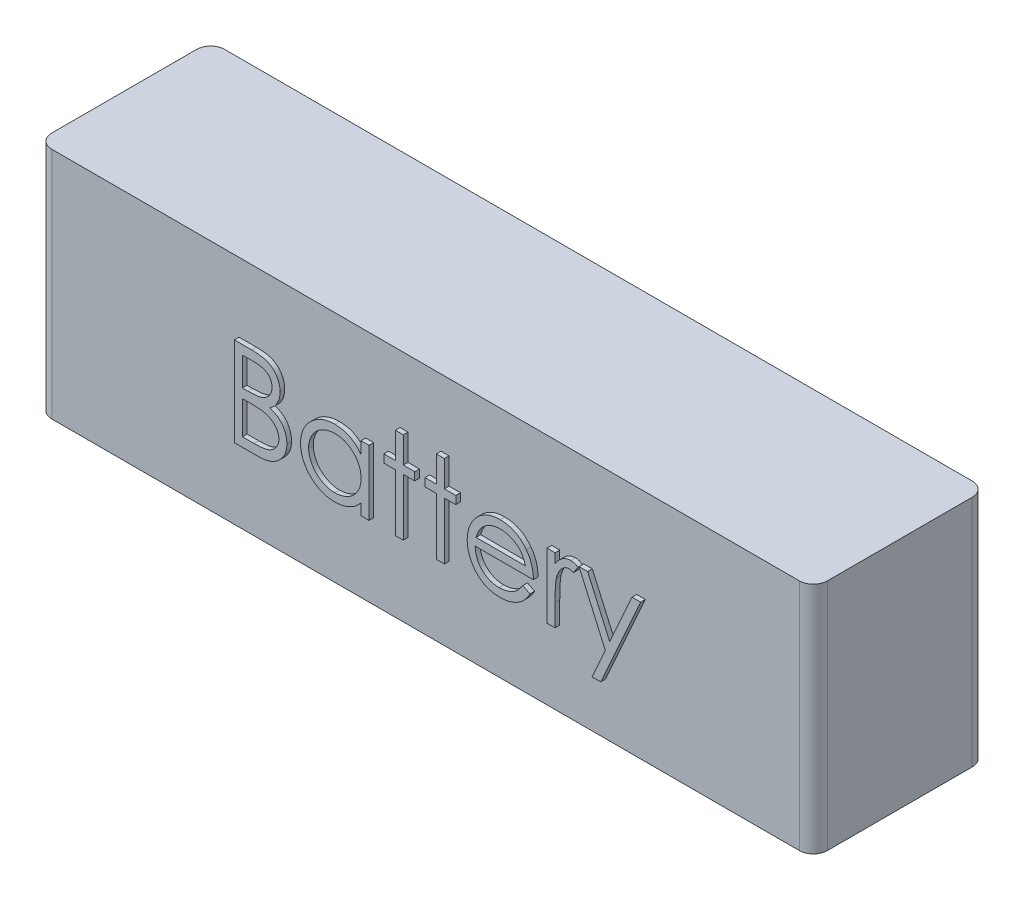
SolidWorks part; units mm, degrees
ref_plane "Front Plane" through (0, 0, 0) normal (0, 0, 1) x (1, 0, 0)
ref_plane "Top Plane" through (0, 0, 0) normal (0, 1, 0) x (1, 0, 0)
ref_plane "Right Plane" through (0, 0, 0) normal (1, 0, 0) x (0, 0, -1)
sketch "Sketch1" plane through (0, 0, 0) normal (0, 1, 0) x (1, 0, 0)
  line L1 (0, 0) -> (166, 0)
  line L2 (0, 0) -> (0, 37)
  line L3 (0, 37) -> (166, 37)
  line L4 (166, 0) -> (166, 37)
  dimension "D1" = 37
  dimension "D2" = 166
extrude "Boss-Extrude1" add sketch "Sketch1" along normal blind 50
fillet "Fillet2" radius 3 4 edges at (166, 25, -37) (166, 25, 0) (0, 25, -37) (0, 25, 0)
ref_point "Point1"
ref_point "Point2"
ref_point "Point3"
ref_point "Point4"
ref_point "Point5"
ref_point "Point6"
ref_point "Point7"
ref_point "Point8"
ref_point "Point9"
ref_plane "Plane1" through (83, 0, 0) normal (1, 0, 0) x (0, 0, -1)
ref_plane "Plane2" through (0, 0, -18.5) normal (0, 0, 1) x (1, 0, 0)
sketch "Sketch2" plane through (0, 0, 0) normal (0, 0, 1) x (1, 0, 0)
  text T0 "Battery" font "Century Gothic" height in points 72
extrude "Boss-Extrude2" add sketch "Sketch2" along normal blind 1
